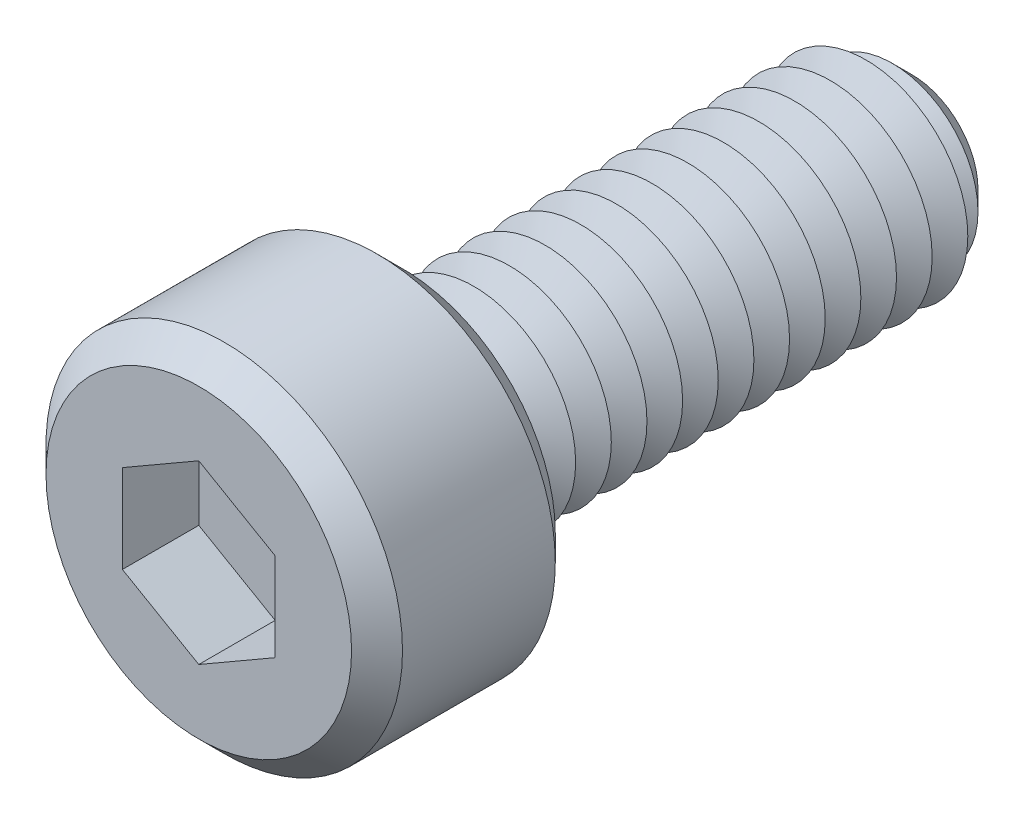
SolidWorks part; units mm, degrees
ref_plane "Front Plane" through (0, 0, 0) normal (0, 0, 1) x (1, 0, 0)
ref_plane "Top Plane" through (0, 0, 0) normal (0, 1, 0) x (1, 0, 0)
ref_plane "Right Plane" through (0, 0, 0) normal (1, 0, 0) x (0, 0, -1)
sketch "Sketch1" plane through (0, 0, 0) normal (0, 0, 1) x (1, 0, 0)
  circle A0 centre (0, 0) radius 3.5
  dimension "D1" = 7
extrude "Boss-Extrude1" add sketch "Sketch1" along normal blind 4
sketch "Sketch2" plane through (0, 0, 0) normal (0, 0, -1) x (-1, 0, 0)
  circle A0 centre (0, 0) radius 2
  dimension "D1" = 4
extrude "Boss-Extrude2" add sketch "Sketch2" along normal blind 10
chamfer "Chamfer1" distance 0.7 angle 45 1 edges at (-2, 0, -10)
sketch "Sketch3" plane through (0, 0, 0) normal (1, 0, 0) x (0, 0, -1)
  line L0 (-2.5121, 0) -> (4.5776, 0) construction
sketch "Sketch4" plane through (0, 0, 0) normal (1, 0, 0) x (0, 0, -1)
  line L0 (0, 2) -> (0.35, 1.3938)
  line L1 (0.35, 1.3938) -> (0.7, 2)
  line L2 (9.3, 2) -> (0, 2) construction
  line L3 (0.7, 2) -> (0, 2)
  dimension "D1" = 0.7
revolve "Cut-Revolve1" cut sketch "Sketch4" angle 360 about L0
pattern_linear "LPattern1" count 14 spacing 0.7 along (0, 0, -1) of "Cut-Revolve1"
sketch "Sketch5" plane through (0, 0, 4) normal (0, 0, 1) x (1, 0, 0)
  line L1 (0, 1.7321) -> (-1.5, 0.866)
  line L2 (-1.5, 0.866) -> (-1.5, -0.866)
  line L3 (-1.5, -0.866) -> (0, -1.7321)
  line L4 (0, -1.7321) -> (1.5, -0.866)
  line L5 (1.5, -0.866) -> (1.5, 0.866)
  line L6 (1.5, 0.866) -> (0, 1.7321)
  circle A0 centre (0, 0) radius 1.5 construction
  dimension "D1" = 3
extrude "Cut-Extrude1" cut sketch "Sketch5" against normal blind 1.5
sketch "Sketch6" plane through (0, 0, 2.5) normal (0, 0, 1) x (1, 0, 0)
  circle A0 centre (0, 0) radius 0.5
  dimension "D1" = 1
extrude "Cut-Extrude2" cut sketch "Sketch6" against normal up to surface (12.5 mm away)
chamfer "Chamfer2" distance 0.5 angle 45 2 edges at (3.5, 0, 0) (3.5, 0, 4)
